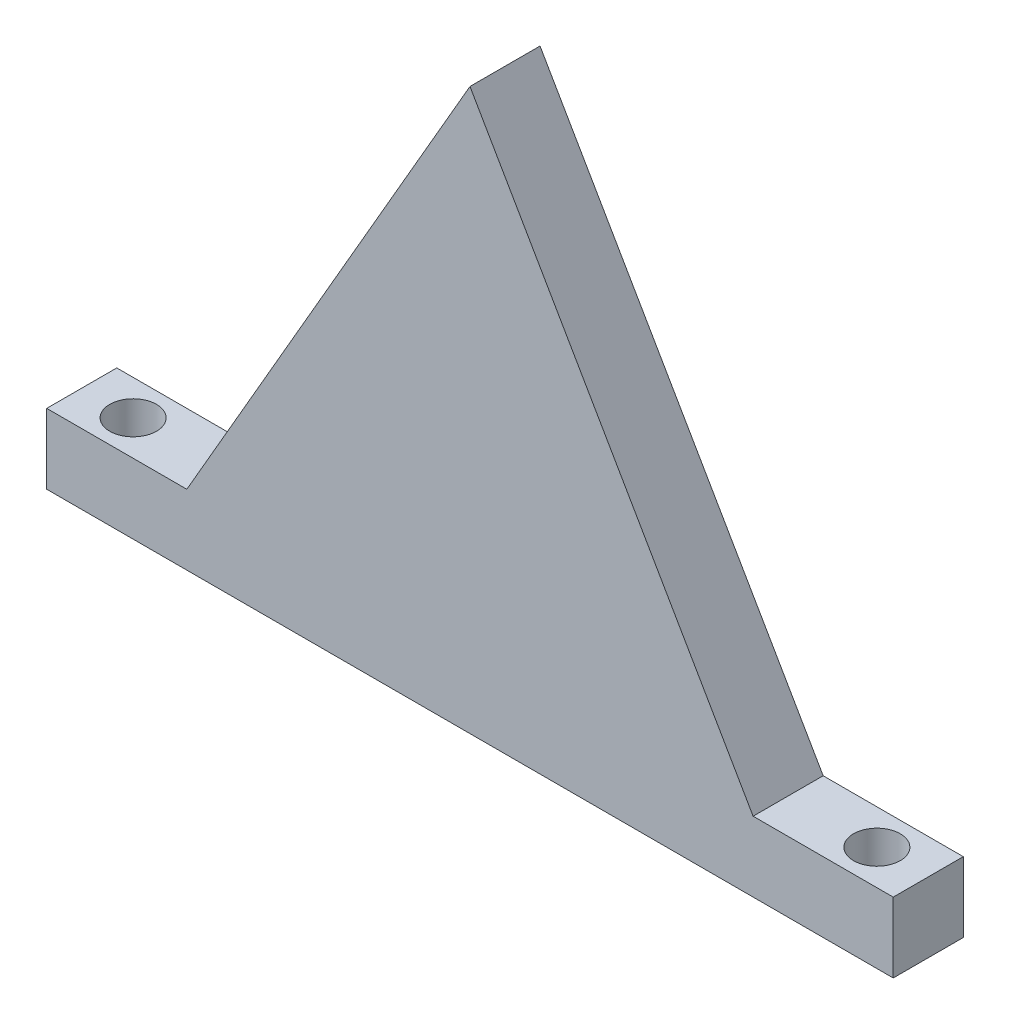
SolidWorks part; units mm, degrees
ref_plane "Front Plane" through (0, 0, 0) normal (0, 0, 1) x (1, 0, 0)
ref_plane "Top Plane" through (0, 0, 0) normal (0, 1, 0) x (1, 0, 0)
ref_plane "Right Plane" through (0, 0, 0) normal (1, 0, 0) x (0, 0, -1)
sketch "Sketch2" plane through (0, 0, 0) normal (0, 0, 1) x (1, 0, 0)
  line L0 (0, 0) -> (115.0897, 0)
  line L1 (115.0897, 0) -> (115.0897, 19.05)
  line L2 (115.0897, 19.05) -> (76.9897, 19.05)
  line L3 (76.9897, 19.05) -> (0, 152.4)
  line L4 (0, 152.4) -> (0, 0)
  line L5 (0, 152.4) -> (30.6387, 152.4) construction
  dimension "D1" = 60
  dimension "D2" = 152.4
  dimension "D3" = 19.05
  dimension "D4" = 38.1
  dimension "D5" = 60
  dimension "D6" = 30
extrude "Boss-Extrude1" add sketch "Sketch2" along normal mid plane 19.05
sketch "Sketch4" plane through (0, 19.05, 0) normal (0, 1, 0) x (1, 0, 0)
  line L0 (115.0897, -9.525) -> (115.0897, 9.525) construction
  circle A0 centre (101.1197, 0) radius 6.35
  dimension "D1" = 12.7
  dimension "D2" = 7.62
extrude "Cut-Extrude1" cut sketch "Sketch4" against normal through all
mirror "Mirror1" about plane through (0, 0, 0) normal (1, 0, 0) of "Cut-Extrude1", "Boss-Extrude1"
